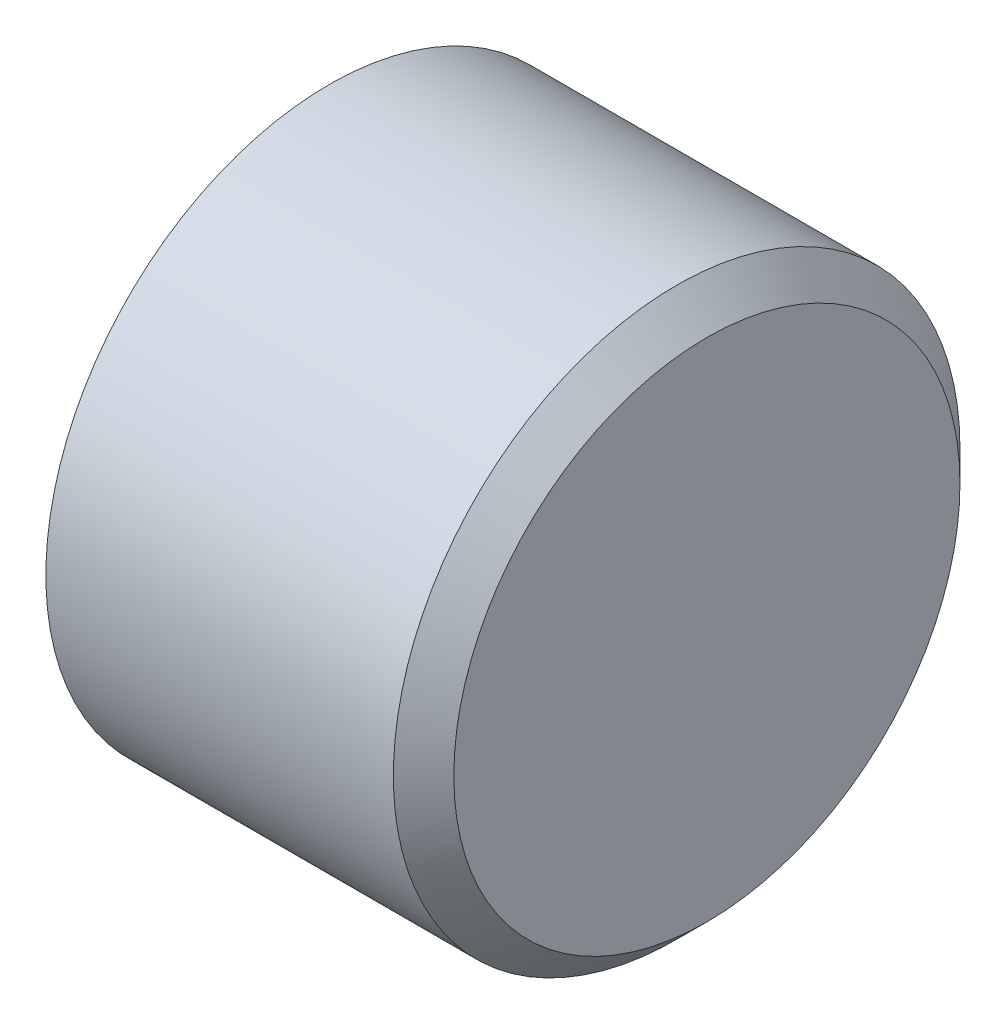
SolidWorks part; units mm, degrees
ref_plane "Front Plane" through (0, 0, 0) normal (0, 0, 1) x (1, 0, 0)
ref_plane "Top Plane" through (0, 0, 0) normal (0, 1, 0) x (1, 0, 0)
ref_plane "Right Plane" through (0, 0, 0) normal (1, 0, 0) x (0, 0, -1)
sketch "Sketch1" plane through (0, 0, 0) normal (0, 0, 1) x (1, 0, 0)
  line L0 (0, 3.175) -> (0, 9.525)
  line L1 (0, 9.525) -> (12.7, 9.525)
  line L2 (12.7, 9.525) -> (12.7, 0)
  line L3 (12.7, 0) -> (9.525, 0)
  line L4 (9.525, 0) -> (9.525, 3.175)
  line L5 (9.525, 3.175) -> (0, 3.175)
  line L6 (0, 0) -> (-9.3334, 0) construction
  dimension "D1" = 19.05
  dimension "D2" = 6.35
  dimension "D3" = 12.7
  dimension "D4" = 9.525
revolve "Revolve1" add sketch "Sketch1" angle 360 about L6
chamfer "Chamfer1" distance 1.016 angle 45 1 edges at (12.7, 0, -9.525)
